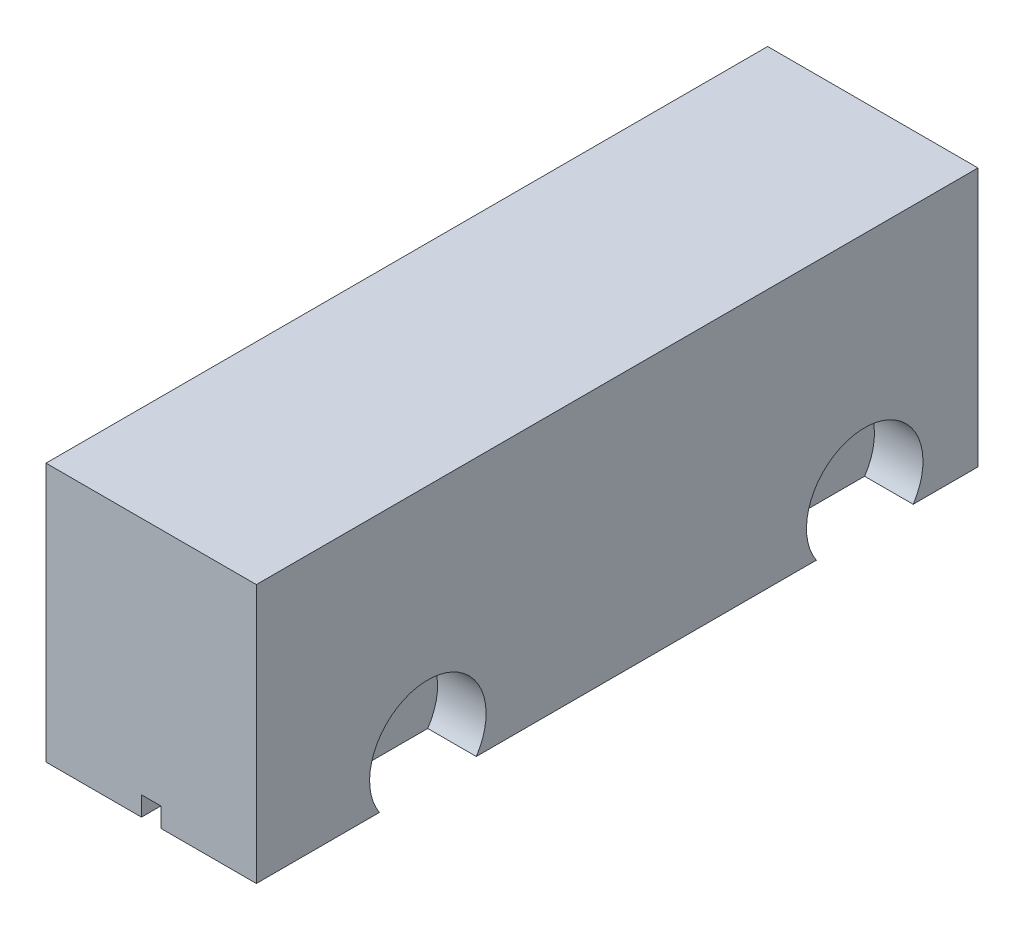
SolidWorks part; units mm, degrees
ref_plane "Front Plane" through (0, 0, 0) normal (0, 0, 1) x (1, 0, 0)
ref_plane "Top Plane" through (0, 0, 0) normal (0, 1, 0) x (1, 0, 0)
ref_plane "Right Plane" through (0, 0, 0) normal (1, 0, 0) x (0, 0, -1)
sketch "Sketch1" plane through (0, 0, 0) normal (0, 0, 1) x (1, 0, 0)
  line L1 (-32.5, 0) -> (32.5, 0)
  line L2 (-32.5, 0) -> (-32.5, 80)
  line L3 (-32.5, 80) -> (32.5, 80)
  line L4 (32.5, 0) -> (32.5, 80)
  dimension "D1" = 65
  dimension "D2" = 80
extrude "Balsa Block" add sketch "Sketch1" along normal blind 223
sketch "Sketch2" plane through (0, 0, 223) normal (0, 0, 1) x (1, 0, 0)
  line L0 (-32.5, 0) -> (32.5, 0) construction
  line L1 (-3, 0) -> (3, 0)
  line L2 (-3, 0) -> (-3, 6)
  line L3 (-3, 6) -> (3, 6)
  line L4 (3, 0) -> (3, 6)
  dimension "D1" = 6
  dimension "D2" = 6
extrude "Screw Eye Slot" cut sketch "Sketch2" against normal through all
sketch "Sketch4" plane through (32.5, 0, 0) normal (1, 0, 0) x (0, 0, -1)
  line L0 (-223, 0) -> (0, 0) construction
  line L1 (0, 0) -> (0, 80) construction
  circle A0 centre (-170, 10) radius 1.525
  circle A1 centre (-35, 10) radius 1.525
  dimension "D4" = 3.05
  dimension "D1" = 10
  dimension "D2" = 135
  dimension "D3" = 35
extrude "Axle Hole Cut Out" cut sketch "Sketch4" against normal through all
sketch "Esquisse1" plane through (32.5, 0, 0) normal (1, 0, 0) x (0, 0, -1)
  circle A0 centre (-170, 10) radius 18
  circle A1 centre (-35, 10) radius 18
  dimension "D1" = 36
  dimension "D2" = 36
extrude "Enlèv. mat.-Extru.1" cut sketch "Esquisse1" against normal blind 15
sketch "Esquisse2" plane through (-32.5, 0, 0) normal (-1, 0, 0) x (0, 0, 1)
  circle A0 centre (35, 10) radius 18
  circle A1 centre (170, 10) radius 18
  dimension "D1" = 36
  dimension "D2" = 36
extrude "Enlèv. mat.-Extru.2" cut sketch "Esquisse2" against normal blind 15
